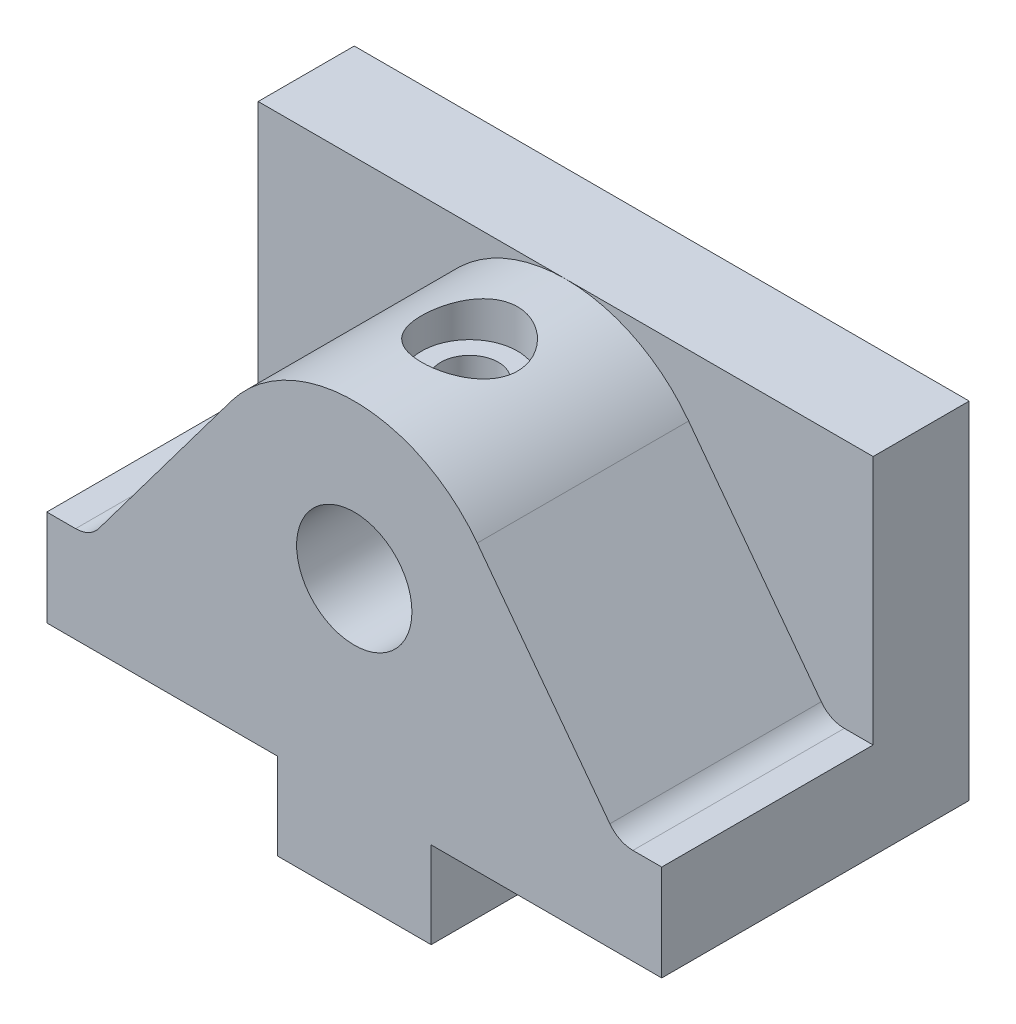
SolidWorks part; units mm, degrees
ref_plane "Front" through (0, 0, 0) normal (0, 0, 1) x (1, 0, 0)
ref_plane "Top" through (0, 0, 0) normal (0, 1, 0) x (1, 0, 0)
ref_plane "Right" through (0, 0, 0) normal (1, 0, 0) x (0, 0, -1)
sketch "Sketch1" plane through (0, 0, 0) normal (0, 0, 1) x (1, 0, 0)
  line L0 (0, 35.7198) -> (0, -31.9855) construction
  line L1 (-32, 22) -> (32, 22)
  line L2 (32, 22) -> (32, -14)
  line L3 (32, -14) -> (8, -14)
  line L4 (8, -14) -> (8, -23)
  line L5 (8, -23) -> (-8, -23)
  line L6 (-8, -14) -> (-8, -23)
  line L7 (-32, -14) -> (-8, -14)
  line L8 (-32, 22) -> (-32, -14)
  point P10 (0, -23)
  point P13 (0, 22)
  dimension "D1" = 64
  dimension "D2" = 36
  dimension "D3" = 9
  dimension "D4" = 16
  dimension "D5" = 23
extrude "Extrude1" add sketch "Sketch1" along normal blind 32
sketch "Sketch2" plane through (0, 0, 32) normal (0, 0, 1) x (1, 0, 0)
  line L0 (12.8, 15.6) -> (27.5, -4)
  line L1 (27.5, -4) -> (32, -4)
  line L2 (32, -14) -> (32, 22) construction
  line L3 (32, 22) -> (-32, 22) construction
  line L4 (0, 30.4947) -> (0, -33.3559) construction
  line L5 (-27.5, -4) -> (-32, -4)
  line L6 (-12.8, 15.6) -> (-27.5, -4)
  line L7 (8, -14) -> (32, -14) construction
  line L8 (-32, -4) -> (-34.9332, -4)
  line L9 (-34.9332, -4) -> (-34.9332, 29.2569)
  line L10 (-34.9332, 29.2569) -> (38.9733, 29.2569)
  line L11 (38.9733, 29.2569) -> (38.9733, -4)
  line L12 (38.9733, -4) -> (32, -4)
  arc A0 (-12.8, 15.6) -> (12.8, 15.6) centre (0, 6) cw
  dimension "D1" = 16
  dimension "D2" = 55
  dimension "D3" = 10
extrude "Cut-Extrude1" cut sketch "Sketch2" against normal blind 22
fillet "Fillet1" radius 3 2 edges at (-27.5, -4, 21) (27.5, -4, 21)
other "Hole1" parameters "D1"=24
sketch "Sketch3" plane through (0, 0, 32) normal (0, 0, 1) x (1, 0, 0)
  circle A0 centre (0, 6) radius 6
  arc A1 (12.8, 15.6) -> (-12.8, 15.6) centre (0, 6) ccw construction
  dimension "D1" = 12
hole_wizard "CBORE for M3 SBHCS1" positions "3DSketch2" profile "Sketch5" counterbore size "M3" standard "Ansi Metric"
sketch3d "3DSketch2"
  line L0 (32, 22, 0) -> (-32, 22, 0) construction
  line L2 (32, 22, 10) -> (32, 22, 0) construction
  point P0 (0, 22, 20)
  dimension "D1" = 20
  dimension "D2" = 32
sketch "Sketch5" plane through (0, 22, 20) normal (1, 0, 0) x (0, 0, 1)
  line L0 (0, 0) -> (0, 10)
  line L1 (0, 10) -> (3, 10)
  line L3 (3, 10) -> (3, 4)
  line L4 (3, 4) -> (5, 4)
  line L5 (5, 4) -> (5, 0)
  line L7 (5, 0) -> (0, 0)
  line L11 (0, -6.35) -> (0, 107.95) construction
  dimension "Thru Hole Dia." = 6
  dimension "Thru Hole Depth" = 10
  dimension "C'Bore Dia." = 10
  dimension "C'Bore Depth" = 4
ref_plane "Plane1" through (0, 0, 24) normal (0, 0, 1) x (1, 0, 0)
sketch "Sketch6" plane through (0, 0, 24) normal (0, 0, 1) x (1, 0, 0)
  line L0 (0, 32.955) -> (0, -32.955) construction
  line L1 (0, -23) -> (3, -23)
  line L2 (-8, -23) -> (8, -23) construction
  line L3 (3, -23) -> (3, -7)
  line L4 (3, -7) -> (0, -5.2679)
  line L5 (0, -5.2679) -> (0, -23)
  dimension "D1" = 16
  dimension "D2" = 6
  dimension "D3" = 60
revolve "Cut-Revolve1" cut sketch "Sketch6" angle 360 about L0
pattern_linear "LPattern1" count 2 spacing 16 along (0, 0, -1) of "Cut-Revolve1"
